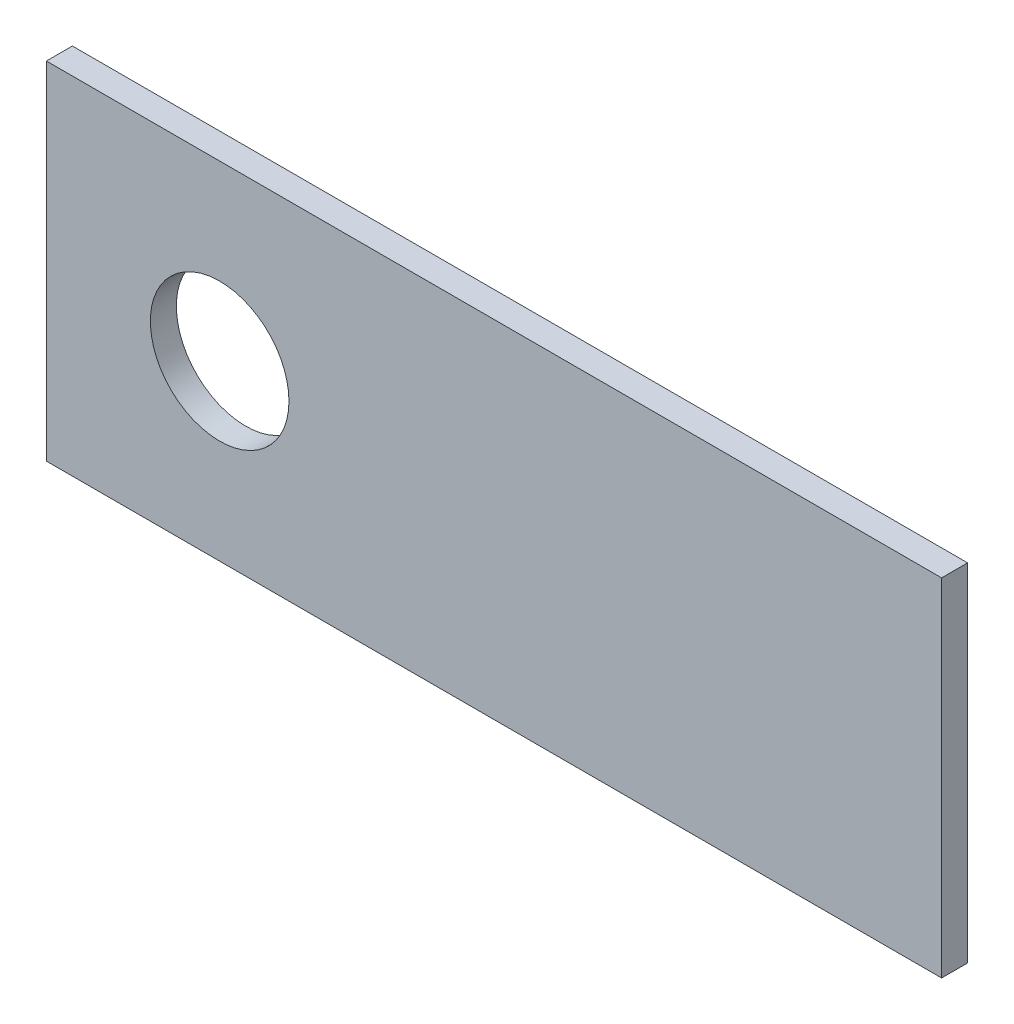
SolidWorks part; units mm, degrees
ref_plane "Front Plane" through (0, 0, 0) normal (0, 0, 1) x (1, 0, 0)
ref_plane "Top Plane" through (0, 0, 0) normal (0, 1, 0) x (1, 0, 0)
ref_plane "Right Plane" through (0, 0, 0) normal (1, 0, 0) x (0, 0, -1)
sketch "Sketch1" plane through (0, 0, 0) normal (0, 0, 1) x (1, 0, 0)
  line L1 (77.5, -30) -> (-77.5, -30)
  line L2 (77.5, -30) -> (77.5, 30)
  line L3 (77.5, 30) -> (-77.5, 30)
  line L4 (-77.5, -30) -> (-77.5, 30)
  line L5 (77.5, -30) -> (-77.5, 30) construction
  line L6 (77.5, 30) -> (-77.5, -30) construction
  point P0 (0, 0)
  dimension "D1" = 155
  dimension "D2" = 60
extrude "Boss-Extrude1" add sketch "Sketch1" along normal blind 4.5
sketch "Sketch2" plane through (0, 0, 4.5) normal (0, 0, 1) x (1, 0, 0)
  line L0 (-77.5, 30) -> (-77.5, -30) construction
  circle A0 centre (-47.5, 0) radius 12
  point P3 (0, 0)
  dimension "D1" = 24
  dimension "D2" = 30
extrude "Cut-Extrude1" cut sketch "Sketch2" against normal blind 10
